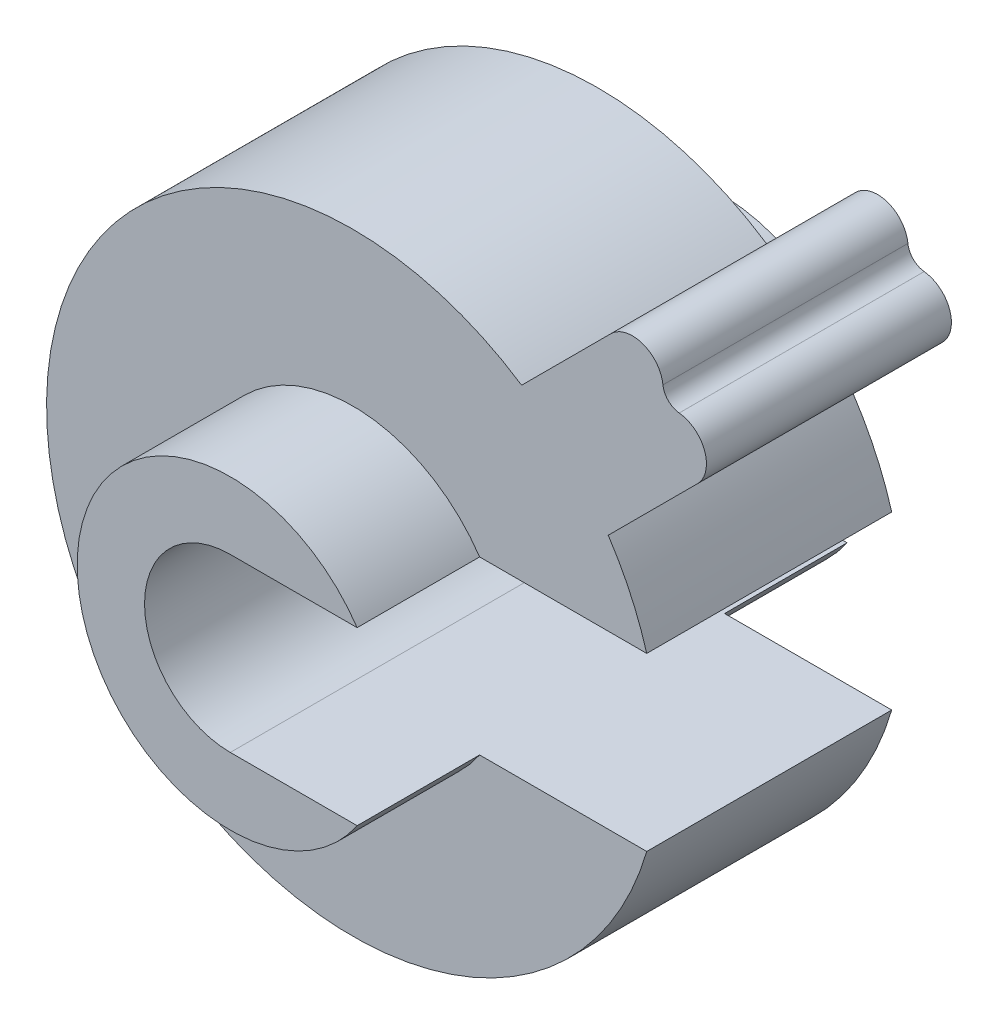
SolidWorks part; units mm, degrees
ref_plane "Plan de face" through (0, 0, 0) normal (0, 0, 1) x (1, 0, 0)
ref_plane "Plan de dessus" through (0, 0, 0) normal (0, 1, 0) x (1, 0, 0)
ref_plane "Plan de droite" through (0, 0, 0) normal (1, 0, 0) x (0, 0, -1)
sketch "Esquisse1" plane through (0, 0, 0) normal (0, 0, 1) x (1, 0, 0)
  circle A0 centre (0, 0) radius 1.25
  dimension "D1" = 2.5
extrude "Boss.-Extru.1" add sketch "Esquisse1" along normal mid plane 4
sketch "Esquisse2" plane through (0, 0, 0) normal (0, 0, 1) x (1, 0, 0)
  circle A0 centre (0, 0) radius 2.5
  dimension "D1" = 5
extrude "Boss.-Extru.2" add sketch "Esquisse2" along normal mid plane 2
sketch "Esquisse3" plane through (0, 0, 2) normal (0, 0, 1) x (1, 0, 0)
  circle A0 centre (0, 0) radius 0.7
  dimension "D1" = 1.4
extrude "Enlèv. mat.-Extru.1" cut sketch "Esquisse3" against normal blind 4.5
sketch "Esquisse4" plane through (0, 0, 2) normal (0, 0, 1) x (1, 0, 0)
  line L0 (0, 0.7) -> (2.7044, 0.7)
  line L1 (2.7044, 0.7) -> (2.7044, -0.7)
  line L2 (2.7044, -0.7) -> (0, -0.7)
  line L3 (0, -0.7) -> (0, 0.7)
  circle A0 centre (0, 0) radius 0.7 construction
extrude "Enlèv. mat.-Extru.2" cut sketch "Esquisse4" against normal blind 4.5
sketch "Esquisse5" plane through (0, 0, 1) normal (0, 0, 1) x (1, 0, 0)
  line L0 (0, 0) -> (2.8284, 2.8284) construction
  line L1 (0, 0) -> (3.3366, 0) construction
  line L2 (3.182, 2.4749) -> (1.7678, 1.0607)
  line L3 (2.4749, 3.182) -> (1.0607, 1.7678)
  line L4 (1.7678, 1.0607) -> (1.0607, 1.7678)
  line L5 (2.4749, 3.182) -> (2.5456, 2.5456)
  line L6 (2.5456, 2.5456) -> (3.182, 2.4749)
  line L7 (2.4749, 3.182) -> (3.182, 2.4749) construction
  circle A1 centre (0, 0) radius 0.5 construction
  dimension "D1" = 1
  dimension "D2" = 45
  dimension "D3" = 4
  dimension "D4" = 0.5
  dimension "D5" = 2
  dimension "D6" = 0.4
extrude "Boss.-Extru.3" add sketch "Esquisse5" against normal blind 2
fillet "Congé1" radius 0.25 2 edges at (3.182, 2.4749, 0) (2.4749, 3.182, 0)
fillet "Congé2" radius 0.15 1 edges at (2.5456, 2.5456, 0)
